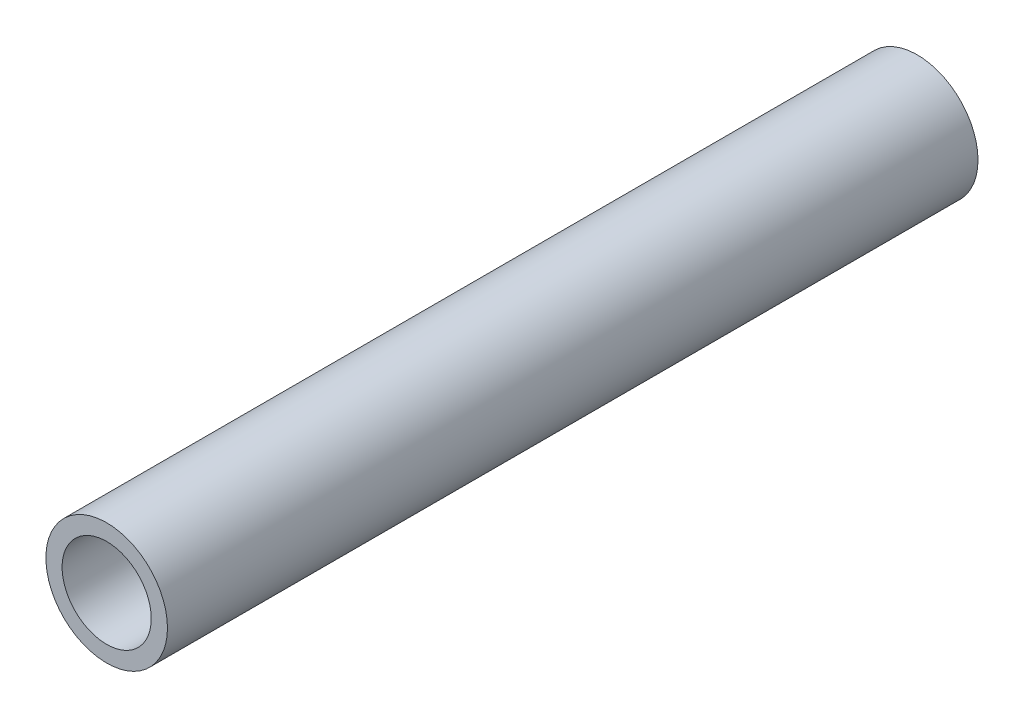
SolidWorks part; units mm, degrees
ref_plane "Front Plane" through (0, 0, 0) normal (0, 0, 1) x (1, 0, 0)
ref_plane "Top Plane" through (0, 0, 0) normal (0, 1, 0) x (1, 0, 0)
ref_plane "Right Plane" through (0, 0, 0) normal (1, 0, 0) x (0, 0, -1)
sketch "Sketch1" plane through (0, 0, 0) normal (0, 0, 1) x (1, 0, 0)
  circle A0 centre (25.4, -101.6) radius 9.525 construction
  circle A1 centre (25.4, -101.6) radius 9.525
  circle A2 centre (25.4, -101.6) radius 6.985
  dimension "D1" = 2.54
extrude "Boss-Extrude1" add sketch "Sketch1" along normal blind 127 contours A1 A2
